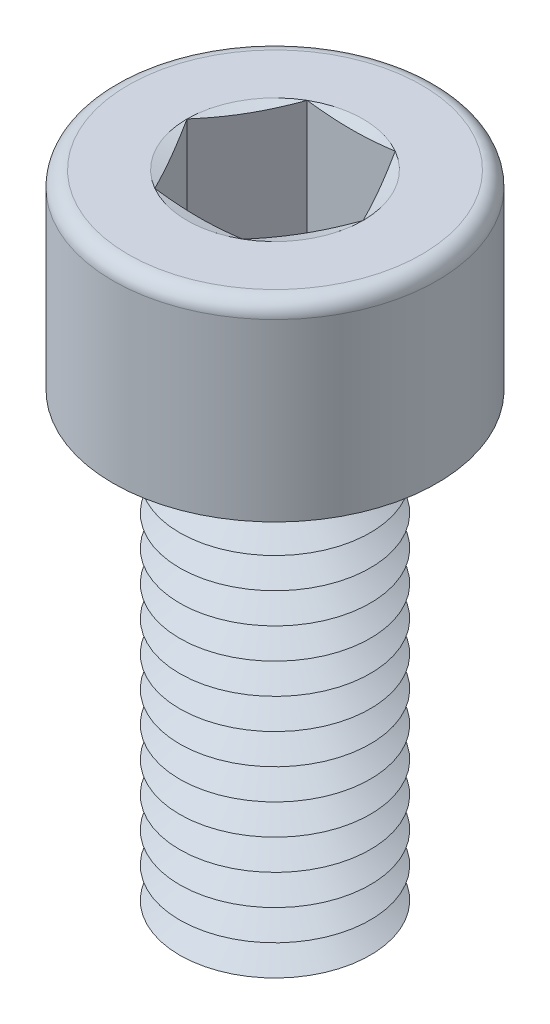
SolidWorks part; units mm, degrees
ref_plane "Front Plane" through (0, 0, 0) normal (0, 0, 1) x (1, 0, 0)
ref_plane "Top Plane" through (0, 0, 0) normal (0, 1, 0) x (1, 0, 0)
ref_plane "Right Plane" through (0, 0, 0) normal (1, 0, 0) x (0, 0, -1)
sketch "Sketch1" plane through (0, 0, 0) normal (0, 1, 0) x (1, 0, 0)
  circle A0 centre (0, 0) radius 2.5
  dimension "D1" = 5
extrude "Extrude1" add sketch "Sketch1" along normal blind 12
sketch "Sketch2" plane through (0, 12, 0) normal (0, 1, 0) x (1, 0, 0)
  circle A0 centre (0, 0) radius 4.25
  dimension "D1" = 8.5
extrude "Extrude2" add sketch "Sketch2" along normal blind 5
sketch "Sketch3" plane through (0, 17, 0) normal (0, 1, 0) x (1, 0, 0)
  line L1 (1.1547, 2) -> (-1.1547, 2)
  line L2 (-1.1547, 2) -> (-2.3094, 0)
  line L3 (-2.3094, 0) -> (-1.1547, -2)
  line L4 (-1.1547, -2) -> (1.1547, -2)
  line L5 (1.1547, -2) -> (2.3094, 0)
  line L6 (2.3094, 0) -> (1.1547, 2)
  circle A0 centre (0, 0) radius 2 construction
  dimension "D1" = 4
extrude "Extrude3" cut sketch "Sketch3" against normal blind 4
fillet "Fillet1" radius 0.4 1 edges at (0, 17, 4.25)
sketch "Sketch4" plane through (0, 0, 0) normal (1, 0, 0) x (0, 0, -1)
  line L0 (-2, 13) -> (0, 13)
  line L1 (0, 13) -> (0, 11.8453)
  line L2 (0, 11.8453) -> (-2, 13)
  dimension "D1" = 30
revolve "Cut-Revolve1" cut sketch "Sketch4" angle 360 about L1
sketch "Sketch5" plane through (0, 0, 0) normal (0, 0, 1) x (1, 0, 0)
  line L0 (-2.5, 0.4) -> (-2.5, -0.4)
  line L1 (-2.5, 12) -> (-2.5, 0) construction
  line L2 (-2.5, -0.4) -> (-1.8072, 0)
  line L3 (-2.5, 0) -> (2.5, 0) construction
  line L4 (-1.8072, 0) -> (-2.5, 0.4)
  dimension "D1" = 0.8
revolve "Cut-Revolve2" cut sketch "Sketch5" angle 360 about axis through (0, 12, 0) along (0, -1, 0)
pattern_linear "LPattern1" count 15 spacing 0.8 along (0, 1, 0) of "Cut-Revolve2"
sketch "Sketch6" plane through (0, 17, 0) normal (0, 1, 0) x (1, 0, 0)
  circle A0 centre (0, 0) radius 2.3094
extrude "Extrude4" cut sketch "Sketch6" against normal through all draft 75
